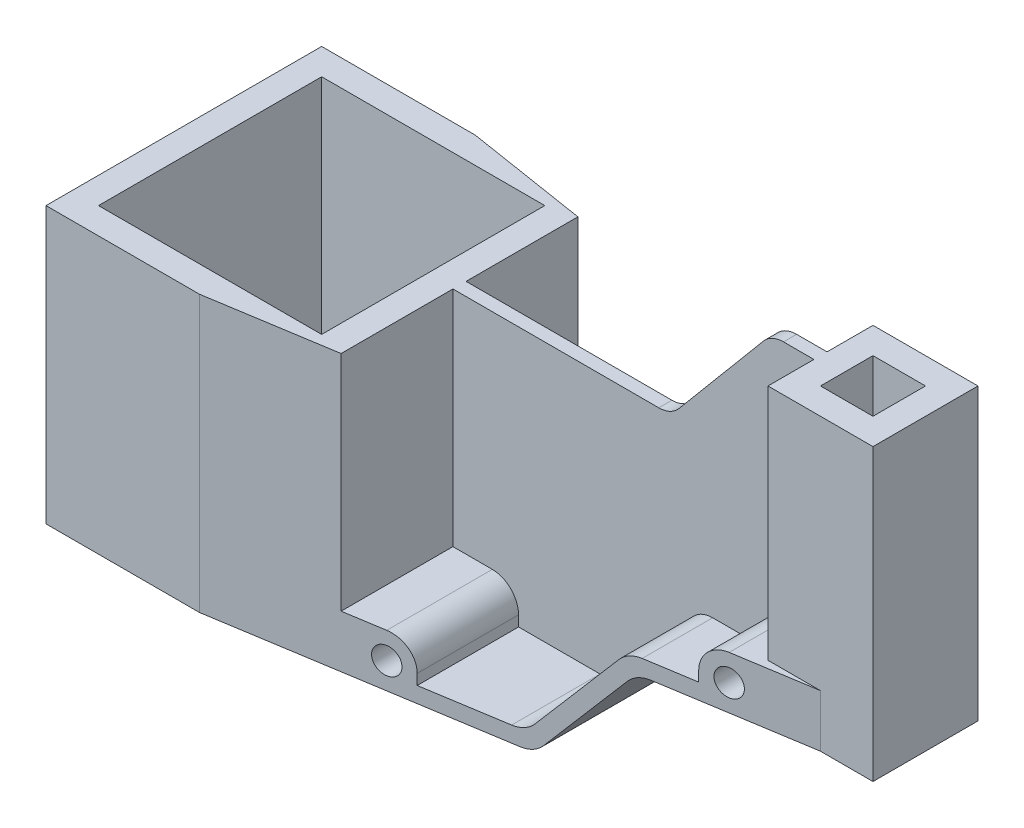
SolidWorks part; units mm, degrees
ref_plane "Front Plane" through (0, 0, 0) normal (0, 0, 1) x (1, 0, 0)
ref_plane "Top Plane" through (0, 0, 0) normal (0, 1, 0) x (1, 0, 0)
ref_plane "Right Plane" through (0, 0, 0) normal (1, 0, 0) x (0, 0, -1)
sketch "Esquisse1" plane through (0, 0, 0) normal (0, 0, 1) x (1, 0, 0)
  line L0 (0, 0) -> (-163.836, 0)
  line L1 (-163.836, 0) -> (-163.836, 105)
  line L2 (-163.836, 105) -> (-58.836, 105)
  line L3 (-58.836, 105) -> (-58.836, 20)
  line L4 (-58.836, 20) -> (-43.836, 20)
  line L5 (-33.836, 6) -> (-2.7978, 6)
  line L6 (4.8626, 9.5721) -> (32.4318, 42.4279)
  line L7 (40.0923, 46) -> (58.664, 46)
  line L8 (58.664, 46) -> (58.664, 50)
  line L10 (7.6604, 3.5721) -> (35.2297, 36.4279)
  line L11 (42.8901, 40) -> (98.664, 40)
  line L13 (-33.836, 10) -> (-33.836, 6)
  line L14 (98.664, 40) -> (98.664, 60)
  line L15 (98.664, 60) -> (68.664, 60)
  line L16 (-58.836, 105) -> (19.5716, 105)
  line L17 (27.232, 108.5721) -> (59.4163, 146.9279)
  line L18 (67.0768, 150.5) -> (118.664, 150.5)
  line L19 (118.664, 150.5) -> (118.664, 40)
  line L20 (118.664, 40) -> (98.664, 40)
  arc A1 (-2.7978, 6) -> (4.8626, 9.5721) centre (-2.7978, 16) ccw
  arc A2 (32.4318, 42.4279) -> (40.0923, 46) centre (40.0923, 36) cw
  arc A4 (35.2297, 36.4279) -> (42.8901, 40) centre (42.8901, 30) cw
  arc A5 (0, 0) -> (7.6604, 3.5721) centre (0, 10) ccw
  arc A6 (-43.836, 20) -> (-33.836, 10) centre (-43.836, 10) cw
  circle A7 centre (-43.836, 10) radius 5
  arc A8 (68.664, 60) -> (58.664, 50) centre (68.664, 50) ccw
  circle A9 centre (68.664, 50) radius 5
  arc A10 (59.4163, 146.9279) -> (67.0768, 150.5) centre (67.0768, 140.5) cw
  arc A11 (19.5716, 105) -> (27.232, 108.5721) centre (19.5716, 115) ccw
  point P30 (-111.336, 105)
  point P32 (38.664, 39.0631)
extrude "Boss.-Extru.1" add sketch "Esquisse1" along normal mid plane 105 contours L15 A8 L8 L7 A2 L6 A1 L5 L13 A6 L4 L3 L2 L1 L0 A5 L10 A4 L11 L14 A9 A7
sketch "Esquisse5" plane through (0, 0, 0) normal (0, 1, 0) x (1, 0, 0)
  line L0 (-105.336, -52.5) -> (98.664, -20)
  line L2 (98.664, -52.5) -> (98.664, 52.5) construction
  line L3 (98.664, -20) -> (98.664, -52.5)
  line L5 (98.664, 0) -> (75.5696, 0) construction
  line L7 (98.664, 20) -> (98.664, 52.5)
  line L8 (-105.336, 52.5) -> (98.664, 20)
  line L11 (-105.336, 52.5) -> (98.664, 52.5)
  line L12 (-105.336, -52.5) -> (98.664, -52.5)
  point P6 (98.664, 0)
extrude "Enlèv. mat.-Extru.1" cut sketch "Esquisse5" along normal through all
sketch "Esquisse8" plane through (0, 60, 0) normal (0, 1, 0) x (1, 0, 0)
  line L0 (98.664, -20) -> (98.664, 20) construction
  line L1 (78.664, -20) -> (118.664, -20)
  line L2 (78.664, -20) -> (78.664, 20)
  line L3 (78.664, 20) -> (118.664, 20)
  line L4 (118.664, -20) -> (118.664, 20)
  line L5 (78.664, -20) -> (118.664, 20) construction
  line L6 (78.664, 20) -> (118.664, -20) construction
  point P0 (98.664, 0)
  dimension "D1" = 20
extrude "Boss.-Extru.2" add sketch "Esquisse8" along normal blind 90.5
sketch "Esquisse9" plane through (0, 40, 0) normal (0, -1, 0) x (1, 0, 0)
  line L4 (98.664, 20) -> (98.664, -20)
  line L5 (98.664, -20) -> (118.664, -20)
  line L6 (118.664, -20) -> (118.664, 20)
  line L7 (118.664, 20) -> (98.664, 20)
  line L8 (98.664, 20) -> (98.664, -20)
  line L9 (98.664, -20) -> (118.664, -20)
  line L10 (118.664, -20) -> (118.664, 20)
  line L11 (118.664, 20) -> (98.664, 20)
  dimension "D1" = 0
extrude "Boss.-Extru.3" add sketch "Esquisse9" against normal up to surface (20 mm away)
sketch "Esquisse11" plane through (0, 0, 0) normal (0, 0, 1) x (1, 0, 0)
  line L0 (27.232, 108.5721) -> (59.4163, 146.9279) construction
  line L1 (67.0768, 150.5) -> (118.664, 150.5) construction
  line L2 (78.664, 150.5) -> (78.664, 60) construction
  line L3 (98.664, 60) -> (68.664, 60) construction
  line L4 (58.664, 46) -> (58.664, 50) construction
  line L5 (40.0923, 46) -> (58.664, 46) construction
  line L6 (4.8626, 9.5721) -> (32.4318, 42.4279) construction
  line L7 (-33.836, 6) -> (-2.7978, 6) construction
  line L8 (-33.836, 10) -> (-33.836, 6) construction
  line L9 (-58.836, 20) -> (-43.836, 20) construction
  line L10 (-58.836, 105) -> (-58.836, 20) construction
  line L11 (-58.836, 105) -> (19.5716, 105) construction
  line L12 (27.232, 108.5721) -> (59.4163, 146.9279)
  line L13 (67.0768, 150.5) -> (78.664, 150.5)
  line L14 (78.664, 150.5) -> (78.664, 60)
  line L15 (78.664, 60) -> (68.664, 60)
  line L16 (58.664, 46) -> (58.664, 50)
  line L17 (40.0923, 46) -> (58.664, 46)
  line L18 (4.8626, 9.5721) -> (32.4318, 42.4279)
  line L19 (-33.836, 6) -> (-2.7978, 6)
  line L20 (-33.836, 10) -> (-33.836, 6)
  line L21 (-58.836, 20) -> (-43.836, 20)
  line L22 (-58.836, 105) -> (-58.836, 20)
  line L23 (-58.836, 105) -> (19.5716, 105)
  arc A0 (19.5716, 105) -> (27.232, 108.5721) centre (19.5716, 115) ccw construction
  arc A1 (67.0768, 150.5) -> (59.4163, 146.9279) centre (67.0768, 140.5) ccw construction
  arc A2 (68.664, 60) -> (58.664, 50) centre (68.664, 50) ccw construction
  arc A3 (40.0923, 46) -> (32.4318, 42.4279) centre (40.0923, 36) ccw construction
  arc A4 (-2.7978, 6) -> (4.8626, 9.5721) centre (-2.7978, 16) ccw construction
  arc A5 (-33.836, 10) -> (-43.836, 20) centre (-43.836, 10) ccw construction
  arc A6 (19.5716, 105) -> (27.232, 108.5721) centre (19.5716, 115) ccw
  arc A7 (67.0768, 150.5) -> (59.4163, 146.9279) centre (67.0768, 140.5) ccw
  arc A8 (68.664, 60) -> (58.664, 50) centre (68.664, 50) ccw
  arc A9 (40.0923, 46) -> (32.4318, 42.4279) centre (40.0923, 36) ccw
  arc A10 (-2.7978, 6) -> (4.8626, 9.5721) centre (-2.7978, 16) ccw
  arc A11 (-33.836, 10) -> (-43.836, 20) centre (-43.836, 10) ccw
extrude "Boss.-Extru.4" add sketch "Esquisse11" along normal mid plane 5
sketch "Esquisse12" plane through (0, 105, 0) normal (0, 1, 0) x (1, 0, 0)
  line L0 (-163.836, 52.5) -> (-105.336, 52.5) construction
  line L1 (-153.836, 42.5) -> (-68.836, 42.5)
  line L2 (-153.836, 42.5) -> (-153.836, -42.5)
  line L3 (-153.836, -42.5) -> (-68.836, -42.5)
  line L4 (-68.836, 42.5) -> (-68.836, -42.5)
  line L5 (-163.836, -52.5) -> (-163.836, 52.5) construction
  line L6 (-163.836, -52.5) -> (-105.336, -52.5) construction
  line L7 (-58.836, -45.0919) -> (-58.836, -2.5) construction
  line L8 (118.664, 20) -> (78.664, 20) construction
  line L9 (88.664, 10) -> (108.664, 10)
  line L10 (88.664, 10) -> (88.664, -10)
  line L11 (88.664, -10) -> (108.664, -10)
  line L12 (108.664, 10) -> (108.664, -10)
  line L13 (118.664, -20) -> (118.664, 20) construction
  line L14 (78.664, -20) -> (118.664, -20) construction
  line L15 (78.664, -2.5) -> (78.664, -20) construction
  dimension "D1" = 10
  dimension "D2" = 10
  dimension "D3" = 10
  dimension "D4" = 10
  dimension "D5" = 10
  dimension "D6" = 10
  dimension "D7" = 10
  dimension "D8" = 10
extrude "Enlèv. mat.-Extru.2" cut sketch "Esquisse12" against normal through all and the other way through all
equation "\"A\" = 210"
equation "\"B\"= 105"
equation "\"W\"= \"B\" / 2"
equation "\"X\"= \"A\" / 4"
equation "\"Y\"= \"B\" + 5.5"
equation "\"Z\"= \"B\" + 15"
equation "\"D1@Esquisse1\"=\"B\""
equation "\"D14@Esquisse1\"=\"B\""
equation "\"D12@Esquisse1\"=\"A\""
equation "\"D21@Esquisse1\"=\"X\""
equation "\"D27@Esquisse1\"=\"Z\""
equation "\"D1@Boss.-Extru.1\"=\"X\"*2"
equation "\"D1@Boss.-Extru.2\"=\"Y\"-20"
equation "\"D1@Esquisse5\"=\"A\"-6"
equation "\"D22@Esquisse1\"=\"Y\""
